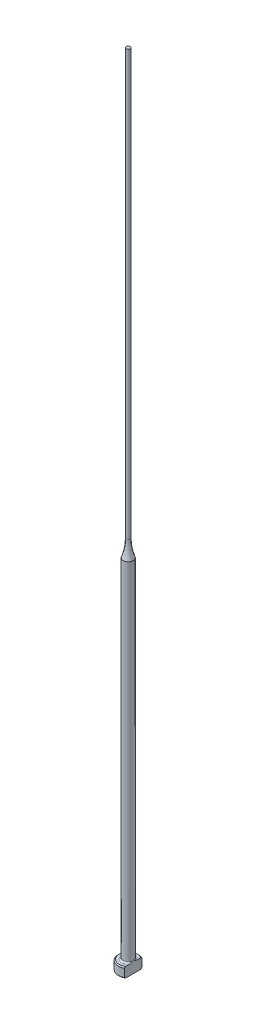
SolidWorks part; units mm, degrees
ref_plane "Front Plane" through (0, 0, 0) normal (0, 0, 1) x (1, 0, 0)
ref_plane "Top Plane" through (0, 0, 0) normal (0, 1, 0) x (1, 0, 0)
ref_plane "Right Plane" through (0, 0, 0) normal (1, 0, 0) x (0, 0, -1)
sketch "Sketch1" plane through (0, 0, 0) normal (0, 0, 1) x (1, 0, 0)
  line L0 (0, 259.9588) -> (0, -15.1925) construction
  line L1 (0, 0) -> (-2, 0)
  line L2 (-2, 0) -> (-2, 2)
  line L3 (-2, 2) -> (-1, 2)
  line L4 (-0.4, 75) -> (-0.4, 160)
  line L5 (-0.4, 160) -> (0, 160)
  line L6 (0, 160) -> (0, 0)
  line L7 (-1, 2) -> (-1, 71.5883)
  arc A0 (-1, 71.5883) -> (-0.4, 75) centre (-10.4, 75) ccw
  point P13 (-1, 0)
  dimension "D1" = 10
  dimension "L" = 160
  dimension "H" = 4
  dimension "T" = 2
  dimension "D" = 0.8
  dimension "B" = 2
  dimension "S" = 75
revolve "Revolve1" add sketch "Sketch1" angle 360 about L0
chamfer "Chamfer1" distance 0.2 angle 45 2 edges at (0, 2, 2) (0, 0, 2)
fillet "Fillet1" radius 0.3 1 edges at (0, 2, 1)
sketch "Sketch2" plane through (0, 0, 0) normal (0, 1, 0) x (1, 0, 0)
  line L0 (1, 1.7321) -> (1, -1.7321)
  circle A0 centre (0, 0) radius 2 construction
  arc A1 (1, -1.7321) -> (1, 1.7321) centre (0, 0) ccw
  circle A2 centre (0, 0) radius 1 construction
extrude "KEY" cut sketch "Sketch2" along normal through all
